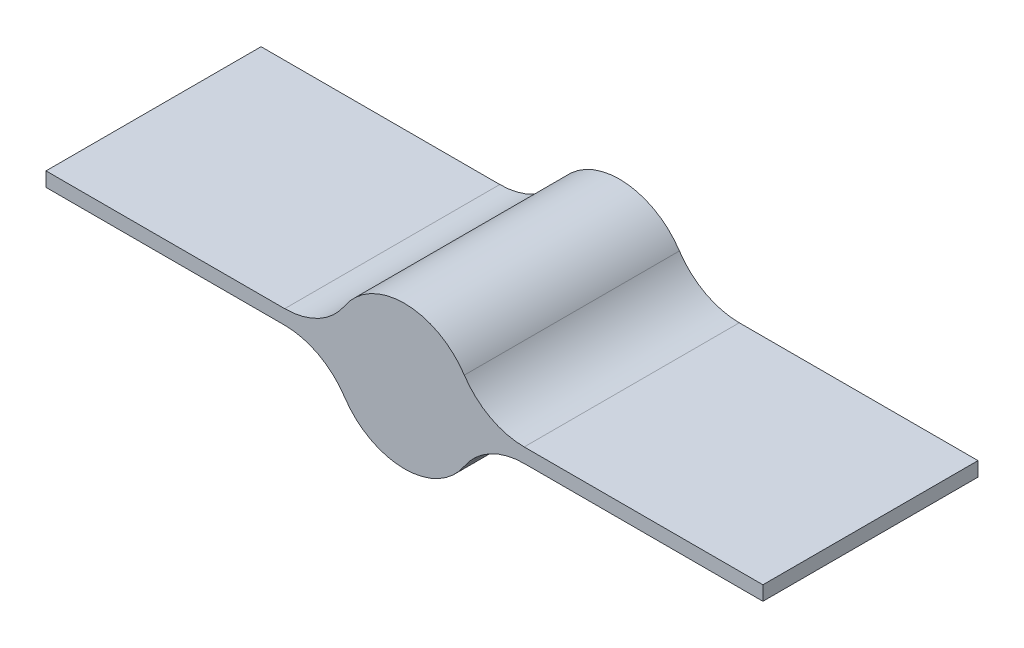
SolidWorks part; units mm, degrees
ref_plane "Front" through (0, 0, 0) normal (0, 0, 1) x (1, 0, 0)
ref_plane "Top" through (0, 0, 0) normal (0, 1, 0) x (1, 0, 0)
ref_plane "Right" through (0, 0, 0) normal (1, 0, 0) x (0, 0, -1)
sketch "Sketch1" plane through (0, 0, 0) normal (0, 0, 1) x (1, 0, 0)
  line L1 (0, 0) -> (100, 0)
  line L2 (0, 0) -> (0, 2)
  line L3 (0, 2) -> (100, 2)
  line L4 (100, 0) -> (100, 2)
  dimension "D1" = 2
  dimension "D2" = 100
extrude "Base-Extrude" add sketch "Sketch1" along normal blind 30
sketch "Sketch2" plane through (0, 0, 30) normal (0, 0, 1) x (1, 0, 0)
  line L0 (50, 29.0402) -> (50, -23.1416) construction
  line L1 (-3.4563, 1) -> (103.7562, 1) construction
  line L2 (0, 2) -> (0, 0) construction
  line L3 (0, 0) -> (100, 0) construction
  circle A0 centre (50, 1) radius 10
  dimension "D3" = 20
  dimension "D1" = 50
  dimension "D2" = 1
extrude "Boss-Extrude1" add sketch "Sketch2" against normal up to surface (30 mm away)
fillet "Fillet4" radius 10
